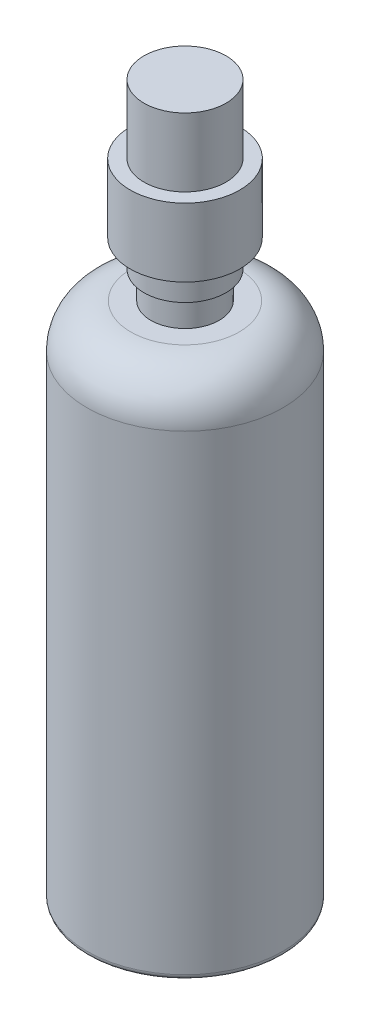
SolidWorks part; units mm, degrees
ref_plane "Front" through (0, 0, 0) normal (0, 0, 1) x (1, 0, 0)
ref_plane "Top" through (0, 0, 0) normal (0, 1, 0) x (1, 0, 0)
ref_plane "Right" through (0, 0, 0) normal (1, 0, 0) x (0, 0, -1)
sketch "Sketch1" plane through (0, 0, 0) normal (0, 0, 1) x (1, 0, 0)
  line L0 (0, -4.5634) -> (0, 24.4983) construction
  line L1 (0, 0) -> (-45.5, 0)
  line L2 (-45.5, 0) -> (-45.5, 241.3)
  line L3 (-45.5, 241.3) -> (-15.875, 241.3)
  line L4 (-15.875, 241.3) -> (-15.875, 254)
  line L5 (-15.875, 254) -> (-19.05, 254)
  line L6 (-19.05, 254) -> (-19.05, 266.7)
  line L7 (-19.05, 266.7) -> (-25.4, 266.7)
  line L8 (-25.4, 266.7) -> (-25.4, 298.45)
  line L9 (-25.4, 298.45) -> (-19.05, 298.45)
  line L10 (-19.05, 298.45) -> (-19.05, 330.2)
  line L11 (-19.05, 330.2) -> (0, 330.2)
  line L12 (0, 330.2) -> (0, 0)
  dimension "D1" = 241.3
  dimension "D2" = 330.2
  dimension "D3" = 31.75
  dimension "D4" = 63.5
  dimension "D5" = 76.2
  dimension "D6" = 91
  dimension "D7" = 31.75
  dimension "D8" = 38.1
  dimension "D9" = 50.8
revolve "Revolve1" add sketch "Sketch1" angle 360 about L0
fillet "Fillet1" radius 20.32 1 edges at (0, 241.3, -45.5)
fillet "Fillet2" radius 2.54 1 edges at (0, 0, -45.5)
